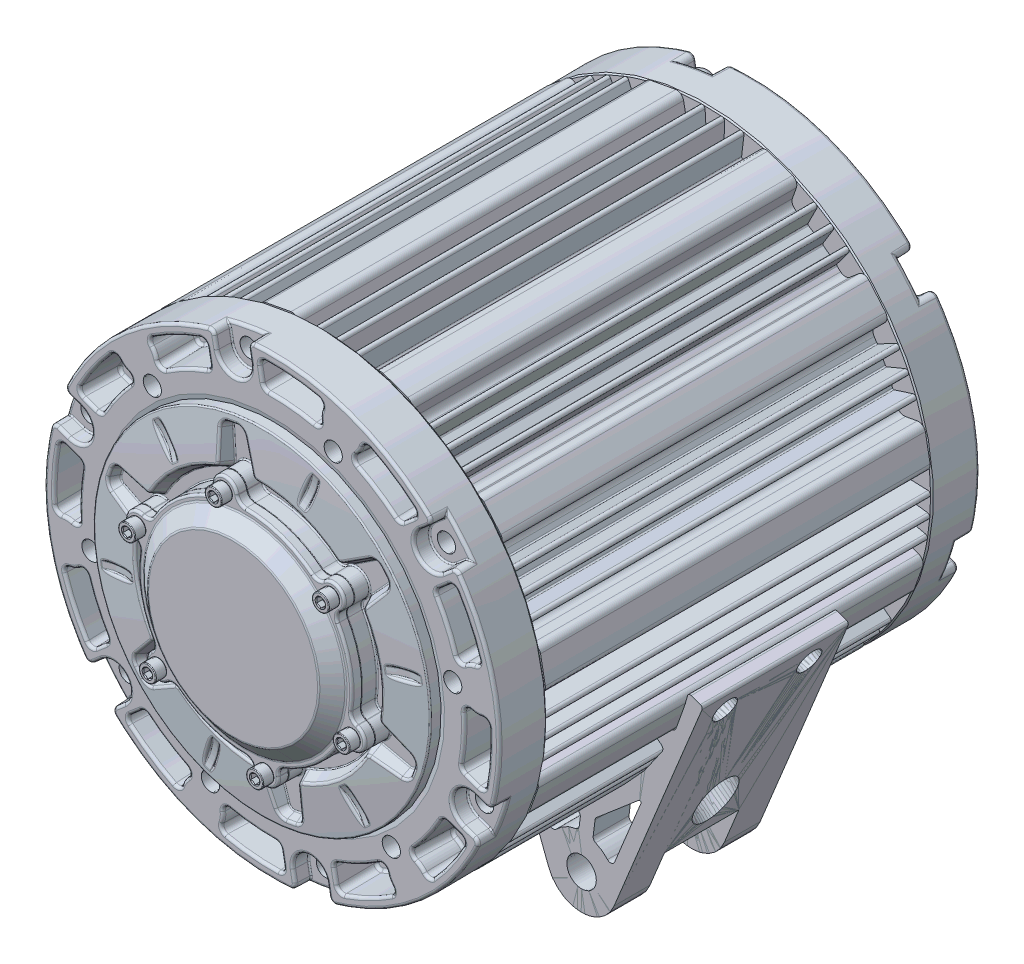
SolidWorks part; units mm, degrees
ref_plane "Front Plane" through (0, 0, 0) normal (0, 0, 1) x (1, 0, 0)
ref_plane "Top Plane" through (0, 0, 0) normal (0, 1, 0) x (1, 0, 0)
ref_plane "Right Plane" through (0, 0, 0) normal (1, 0, 0) x (0, 0, -1)
imported_body "Imported3"
imported_body "Imported4"
imported_body "Imported5"
imported_body "Imported6"
imported_body "Imported7"
imported_body "Imported8"
imported_body "Imported11"
imported_body "Imported12"
imported_body "Imported13"
imported_body "Imported14"
imported_body "Imported15"
imported_body "Imported16"
imported_body "Surface-Imported1"
imported_body "Imported17"
imported_body "Imported18"
imported_body "Imported19"
imported_body "Imported20"
imported_body "Imported21"
imported_body "Imported22"
imported_body "Imported23"
imported_body "Imported24"
imported_body "Imported25"
imported_body "Imported26"
imported_body "Imported27"
imported_body "Imported28"
imported_body "Imported29"
imported_body "Imported30"
imported_body "Imported31"
imported_body "Imported32"
imported_body "Imported33"
imported_body "Imported34"
imported_body "Imported35"
imported_body "Imported36"
imported_body "Imported37"
imported_body "Imported38"
imported_body "Imported39"
imported_body "Imported40"
imported_body "Imported41"
ref_plane "Plane1" through (0, 0, -203.2) normal (0, 0, 1) x (1, 0, 0)
surface "Surface-Trim1"
sketch "Sketch2" plane through (0, 0, -201.9765) normal (0, 0, -1) x (-1, 0, 0)
  circle A0 centre (-1264.8182, 4030.9896) radius 12.954
  circle A1 centre (-1264.8182, 4030.9896) radius 10
  dimension "D1" = 25.908
  dimension "D2" = 20
sketch "Sketch3" plane through (0, 0, -201.9765) normal (0, 0, -1) x (-1, 0, 0)
  circle A0 centre (-1264.8182, 4030.9896) radius 12.954 construction
  circle A1 centre (-1264.8182, 4030.9896) radius 12.954
extrude "Boss-Extrude1" add sketch "Sketch3" along normal blind 5.9944 separate body
sketch "Sketch4" plane through (0, 0, -201.9765) normal (0, 0, -1) x (-1, 0, 0)
  circle A0 centre (-1264.8182, 4030.9896) radius 10 construction
  circle A1 centre (-1264.8182, 4030.9896) radius 10
extrude "Boss-Extrude2" add sketch "Sketch4" along normal blind 27.94
chamfer "Chamfer1" distance 0.762 angle 45 1 edges at (1254.8182, 4030.9896, -229.9165)
